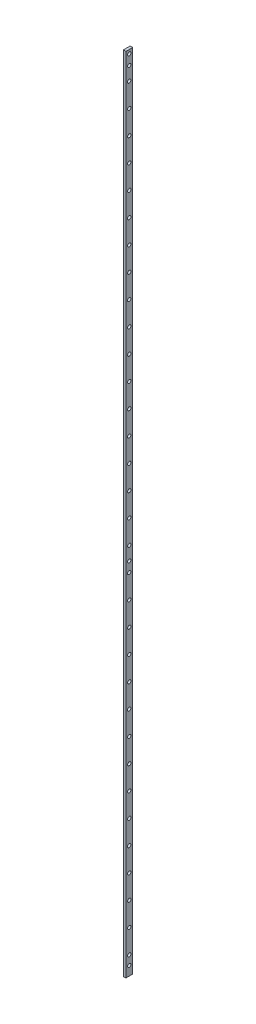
SolidWorks part; units mm, degrees
ref_plane "Alzado" through (0, 0, 0) normal (0, 0, 1) x (1, 0, 0)
ref_plane "Planta" through (0, 0, 0) normal (0, 1, 0) x (1, 0, 0)
ref_plane "Vista lateral" through (0, 0, 0) normal (1, 0, 0) x (0, 0, -1)
sketch "Croquis2" plane through (0, 0, 0) normal (1, 0, 0) x (0, 0, -1)
  line L0 (0, 0) -> (0, 1500)
  line L1 (0, 1500) -> (12.7, 1500)
  line L2 (12.7, 1500) -> (12.7, 0)
  line L3 (12.7, 0) -> (0, 0)
  dimension "D1" = 1500
  dimension "D2" = 12.7
extrude "Saliente-Extruir2" add sketch "Croquis2" along normal blind 4.8
sketch "Croquis3" plane through (4.8, 0, 0) normal (1, 0, 0) x (0, 0, -1)
  line L0 (0, 0) -> (12.7, 0) construction
  line L1 (12.7, 0) -> (12.7, 1500) construction
  circle A0 centre (6.35, 34.3) radius 3.15
  dimension "D2" = 6.3
  dimension "D1" = 34.3
  dimension "D3" = 6.35
extrude "Cortar-Extruir1" cut sketch "Croquis3" against normal through all
pattern_linear "MatrizL1" count 34 spacing 44.2 along (0, 1, 0) of "Cortar-Extruir1"
sketch "Croquis6" plane through (4.8, 0, 0) normal (1, 0, 0) x (0, 0, -1)
  line L1 (12.7, 1500) -> (0, 1500) construction
  line L2 (0, 1500) -> (0, 0) construction
  line L3 (0, 0) -> (12.7, 0) construction
  circle A1 centre (6.35, 1474) radius 3.15
  circle A2 centre (6.35, 17.15) radius 3.15
  circle A3 centre (6.35, 672) radius 3.15
  dimension "D3" = 6.3
  dimension "D4" = 6.3
  dimension "D7" = 672
  dimension "D8" = 6.3
  dimension "D1" = 26
  dimension "D2" = 6.35
  dimension "D5" = 17.15
  dimension "D6" = 6.35
  dimension "D9" = 6.35
extrude "SOPORTES VARILLAS 1-4\"" cut sketch "Croquis6" against normal through all
